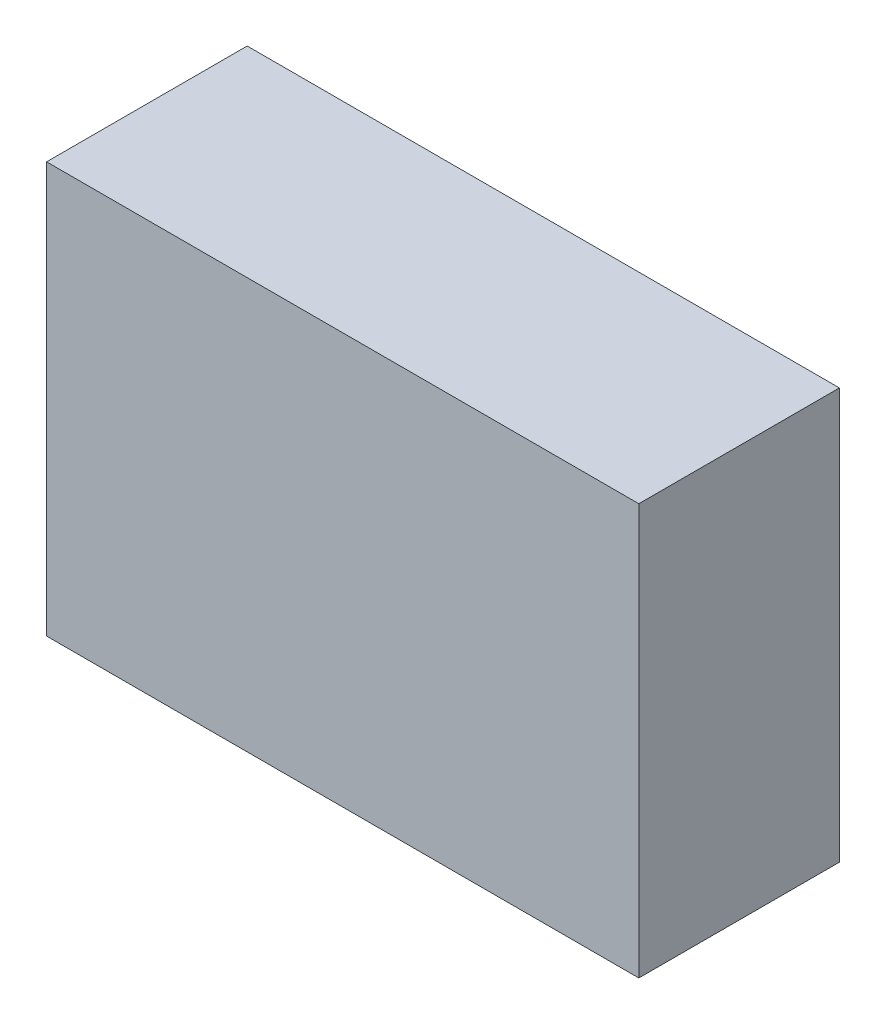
SolidWorks part; units mm, degrees
ref_plane "Front Plane" through (0, 0, 0) normal (0, 0, 1) x (1, 0, 0)
ref_plane "Top Plane" through (0, 0, 0) normal (0, 1, 0) x (1, 0, 0)
ref_plane "Right Plane" through (0, 0, 0) normal (1, 0, 0) x (0, 0, -1)
sketch "Sketch1" plane through (0, 0, 0) normal (0, 0, 1) x (1, 0, 0)
  line L1 (-31, 21.5) -> (31, 21.5)
  line L2 (-31, 21.5) -> (-31, -21.5)
  line L3 (-31, -21.5) -> (31, -21.5)
  line L4 (31, 21.5) -> (31, -21.5)
  line L5 (-31, 21.5) -> (31, -21.5) construction
  line L6 (-31, -21.5) -> (31, 21.5) construction
  point P0 (0, 0)
  dimension "D1" = 43
  dimension "D2" = 62
extrude "Boss-Extrude1" add sketch "Sketch1" along normal blind 21
